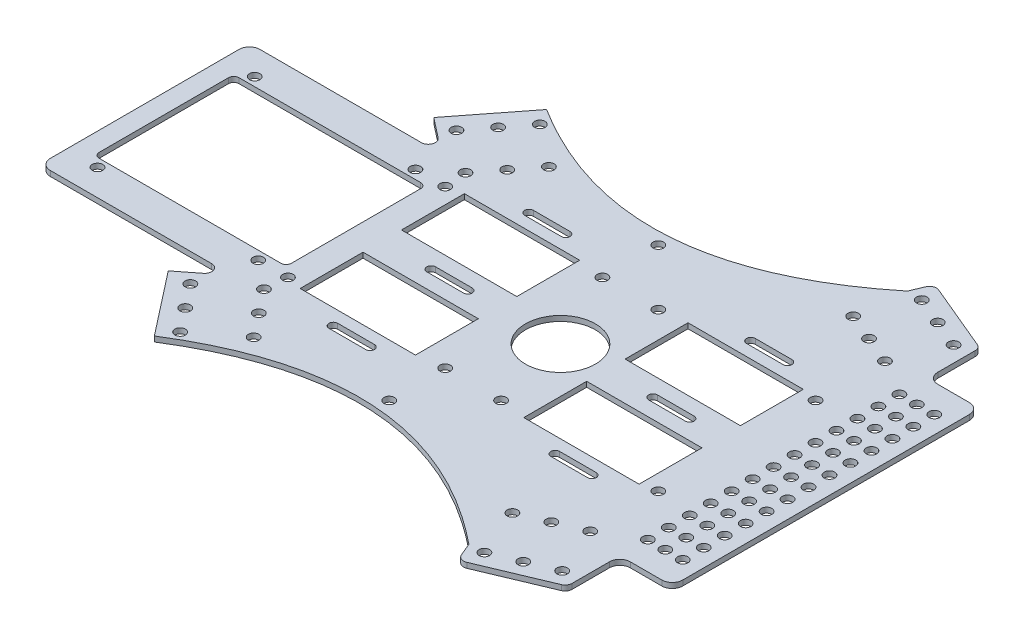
SolidWorks part; units mm, degrees
ref_plane "Спереди" through (0, 0, 0) normal (0, 0, 1) x (1, 0, 0)
ref_plane "Сверху" through (0, 0, 0) normal (0, 1, 0) x (1, 0, 0)
ref_plane "Справа" through (0, 0, 0) normal (1, 0, 0) x (0, 0, -1)
sketch "Эскиз1" plane through (0, 0, 0) normal (0, 1, 0) x (1, 0, 0)
  line L0 (-19.0468, 0) -> (190.9532, 0) construction
  line L1 (0, -27) -> (0, 27)
  line L2 (3, 30) -> (49.1883, 30)
  line L3 (50.419, 33.5765) -> (44.753, 38)
  line L4 (44.753, 38) -> (58.9069, 56.1292)
  line L5 (195, -41) -> (195, 41)
  line L6 (192, 44) -> (183, 44)
  line L7 (180, 47) -> (180, 57.6706)
  line L8 (178.7742, 59.5146) -> (159.7152, 67.5162)
  line L9 (157.0969, 66.4463) -> (155.5485, 62.7581)
  line L10 (157.0969, -66.4463) -> (155.5485, -62.7581)
  line L11 (178.7742, -59.5146) -> (159.7152, -67.5162)
  line L12 (180, -47) -> (180, -57.6706)
  line L13 (192, -44) -> (183, -44)
  line L14 (44.753, -38) -> (58.9069, -56.1292)
  line L15 (50.419, -33.5765) -> (44.753, -38)
  line L16 (3, -30) -> (49.1883, -30)
  arc A0 (0, 27) -> (3, 30) centre (3, 27) cw
  arc A1 (49.1883, 30) -> (50.419, 33.5765) centre (49.1883, 32) ccw
  arc A2 (180, 57.6706) -> (178.7742, 59.5146) centre (178, 57.6706) ccw
  arc A3 (159.7152, 67.5162) -> (157.0969, 66.4463) centre (158.941, 65.6721) ccw
  arc A4 (195, 41) -> (192, 44) centre (192, 41) ccw
  arc A5 (183, 44) -> (180, 47) centre (183, 47) cw
  arc A6 (183, -44) -> (180, -47) centre (183, -47) ccw
  arc A7 (195, -41) -> (192, -44) centre (192, -41) cw
  arc A8 (159.7152, -67.5162) -> (157.0969, -66.4463) centre (158.941, -65.6721) cw
  arc A9 (180, -57.6706) -> (178.7742, -59.5146) centre (178, -57.6706) cw
  arc A10 (49.1883, -30) -> (50.419, -33.5765) centre (49.1883, -32) cw
  arc A11 (0, -27) -> (3, -30) centre (3, -27) ccw
  spline S0 degree 2 poles (58.9069, 56.1292) (108.8246, 24.8356) (155.5485, 62.7581) knots 0 0 0 1 1 1
  spline S1 degree 2 poles (58.9069, -56.1292) (108.8246, -24.8356) (155.5485, -62.7581) knots 0 0 0 1 1 1
  point P17 (0, 30)
  point P20 (55, 30)
  point P23 (180, 59)
  point P26 (157.8711, 68.2904)
  point P29 (195, 44)
  point P32 (180, 44)
  point P34 (195, 0)
  point P35 (0, 0)
  point P55 (180, -44)
  point P56 (195, -44)
  point P57 (157.8711, -68.2904)
  point P58 (180, -59)
  point P59 (55, -30)
  point P60 (0, -30)
  dimension "D12" = 3
  dimension "D13" = 2
  dimension "D14" = 2
  dimension "D15" = 3
  dimension "D1" = 55
  dimension "D2" = 13
  dimension "D3" = 8
  dimension "D4" = 23
  dimension "D5" = 44
  dimension "D6" = 195
  dimension "D7" = 15
  dimension "D8" = 15
  dimension "D9" = 24
  dimension "D10" = 90
  dimension "D11" = 42
extrude "Бобышка-Вытянуть2" add sketch "Эскиз1" along normal blind 1.5
sketch "Эскиз5" plane through (0, 1.5, 0) normal (0, 1, 0) x (1, 0, 0)
  line L0 (-5.1377, 0) -> (72.518, 0) construction
  line L1 (0, 27) -> (0, -27) construction
  line L2 (7, 20) -> (59, 20)
  line L3 (5.5, 18.5) -> (5.5, -18.5)
  line L4 (7, -20) -> (59, -20)
  line L5 (60.5, 18.5) -> (60.5, -18.5)
  line L6 (5.5, 20) -> (60.5, -20) construction
  line L7 (5.5, -20) -> (60.5, 20) construction
  arc A0 (5.5, -18.5) -> (7, -20) centre (7, -18.5) ccw
  arc A1 (59, -20) -> (60.5, -18.5) centre (59, -18.5) ccw
  arc A2 (59, 20) -> (60.5, 18.5) centre (59, 18.5) cw
  arc A3 (7, 20) -> (5.5, 18.5) centre (7, 18.5) ccw
  point P3 (33, 0)
  dimension "D1" = 40
  dimension "D4" = 1.5
  dimension "D2" = 55
  dimension "D3" = 5.5
extrude "дыры под мозгом" cut sketch "Эскиз5" against normal through all
sketch "Эскиз6" plane through (0, 1.5, 0) normal (0, 1, 0) x (1, 0, 0)
  line L0 (-28.3535, 0) -> (207.1956, 0) construction
  line L1 (0, 27) -> (0, -27) construction
  line L2 (68, 5.5) -> (101, 5.5)
  line L3 (68, 5.5) -> (68, 23.5)
  line L4 (68, 23.5) -> (101, 23.5)
  line L5 (101, 5.5) -> (101, 23.5)
  line L6 (132, 23.5) -> (165, 23.5)
  line L7 (132, 23.5) -> (132, 5.5)
  line L8 (132, 5.5) -> (165, 5.5)
  line L9 (165, 23.5) -> (165, 5.5)
  line L10 (195, -41) -> (195, 41) construction
  line L11 (145.5, 0) -> (156, 0) construction
  line L12 (145.5, 1.25) -> (156, 1.25)
  line L13 (145.5, -1.25) -> (156, -1.25)
  line L14 (82, 0) -> (92.5, 0) construction
  line L15 (82, 1.25) -> (92.5, 1.25)
  line L16 (82, -1.25) -> (92.5, -1.25)
  line L17 (145.5, 28) -> (156, 28) construction
  line L18 (145.5, 29.25) -> (156, 29.25)
  line L19 (145.5, 26.75) -> (156, 26.75)
  line L20 (82, 28) -> (92.5, 28) construction
  line L21 (82, 29.25) -> (92.5, 29.25)
  line L22 (82, 26.75) -> (92.5, 26.75)
  line L23 (145.5, -28) -> (156, -28) construction
  line L24 (145.5, -29.25) -> (156, -29.25)
  line L25 (145.5, -26.75) -> (156, -26.75)
  line L26 (82, -28) -> (92.5, -28) construction
  line L27 (82, -29.25) -> (92.5, -29.25)
  line L28 (82, -26.75) -> (92.5, -26.75)
  line L29 (165, -23.5) -> (165, -5.5)
  line L30 (132, -5.5) -> (165, -5.5)
  line L31 (132, -23.5) -> (132, -5.5)
  line L32 (132, -23.5) -> (165, -23.5)
  line L33 (101, -5.5) -> (101, -23.5)
  line L34 (68, -23.5) -> (101, -23.5)
  line L35 (68, -5.5) -> (68, -23.5)
  line L36 (68, -5.5) -> (101, -5.5)
  circle A0 centre (119, 0) radius 10
  arc A1 (145.5, 1.25) -> (145.5, -1.25) centre (145.5, 0) ccw
  arc A2 (156, -1.25) -> (156, 1.25) centre (156, 0) ccw
  arc A3 (82, 1.25) -> (82, -1.25) centre (82, 0) ccw
  arc A4 (92.5, -1.25) -> (92.5, 1.25) centre (92.5, 0) ccw
  arc A5 (145.5, 29.25) -> (145.5, 26.75) centre (145.5, 28) ccw
  arc A6 (156, 26.75) -> (156, 29.25) centre (156, 28) ccw
  arc A7 (82, 29.25) -> (82, 26.75) centre (82, 28) ccw
  arc A8 (92.5, 26.75) -> (92.5, 29.25) centre (92.5, 28) ccw
  arc A9 (145.5, -29.25) -> (145.5, -26.75) centre (145.5, -28) cw
  arc A10 (156, -26.75) -> (156, -29.25) centre (156, -28) cw
  arc A11 (82, -29.25) -> (82, -26.75) centre (82, -28) cw
  arc A12 (92.5, -26.75) -> (92.5, -29.25) centre (92.5, -28) cw
  point P19 (150.75, 0)
  point P26 (87.25, 0)
  point P33 (150.75, 28)
  point P40 (87.25, 28)
  point P47 (150.75, -28)
  point P54 (87.25, -28)
  dimension "D9" = 76
  dimension "D1" = 18
  dimension "D2" = 33
  dimension "D3" = 18
  dimension "D4" = 33
  dimension "D5" = 5.5
  dimension "D6" = 5.5
  dimension "D7" = 68
  dimension "D8" = 30
  dimension "D10" = 2.5
  dimension "D11" = 10.5
  dimension "D12" = 39
  dimension "D13" = 82
extrude "дыры центр" cut sketch "Эскиз6" against normal through all
sketch "Эскиз7" plane through (0, 1.5, 0) normal (0, 1, 0) x (1, 0, 0)
  line L0 (195, -41) -> (195, 41) construction
  line L1 (192, 44) -> (183, 44) construction
  circle A0 centre (190, 36) radius 1.5
  circle A1 centre (185, 36) radius 1.5
  circle A2 centre (180, 36) radius 1.5
  circle A3 centre (190, 30) radius 1.5
  circle A4 centre (185, 30) radius 1.5
  circle A5 centre (180, 30) radius 1.5
  circle A6 centre (190, 24) radius 1.5
  circle A7 centre (185, 24) radius 1.5
  circle A8 centre (180, 24) radius 1.5
  circle A9 centre (190, 18) radius 1.5
  circle A10 centre (185, 18) radius 1.5
  circle A11 centre (180, 18) radius 1.5
  circle A12 centre (190, 12) radius 1.5
  circle A13 centre (185, 12) radius 1.5
  circle A14 centre (180, 12) radius 1.5
  circle A15 centre (190, 6) radius 1.5
  circle A16 centre (185, 6) radius 1.5
  circle A17 centre (180, 6) radius 1.5
  circle A18 centre (190, 0) radius 1.5
  circle A19 centre (185, 0) radius 1.5
  circle A20 centre (180, 0) radius 1.5
  circle A21 centre (190, -6) radius 1.5
  circle A22 centre (185, -6) radius 1.5
  circle A23 centre (180, -6) radius 1.5
  circle A24 centre (190, -12) radius 1.5
  circle A25 centre (185, -12) radius 1.5
  circle A26 centre (180, -12) radius 1.5
  circle A27 centre (190, -18) radius 1.5
  circle A28 centre (185, -18) radius 1.5
  circle A29 centre (180, -18) radius 1.5
  circle A30 centre (190, -24) radius 1.5
  circle A31 centre (185, -24) radius 1.5
  circle A32 centre (180, -24) radius 1.5
  circle A33 centre (190, -30) radius 1.5
  circle A34 centre (185, -30) radius 1.5
  circle A35 centre (180, -30) radius 1.5
  circle A36 centre (190, -36) radius 1.5
  circle A37 centre (185, -36) radius 1.5
  circle A38 centre (180, -36) radius 1.5
  dimension "D1" = 3
  dimension "D2" = 3
  dimension "D3" = 3
  dimension "D4" = 5
  dimension "D5" = 5
  dimension "D6" = 5
  dimension "D7" = 8
  dimension "D8" = 13
extrude "масив отв перед" cut sketch "Эскиз7" against normal through all
sketch "Эскиз8" plane through (0, 1.5, 0) normal (0, 1, 0) x (1, 0, 0)
  line L0 (44.753, 38) -> (50.419, 33.5765) construction
  line L1 (58.9069, 56.1292) -> (44.753, 38) construction
  line L2 (157.0969, 66.4463) -> (155.5485, 62.7581) construction
  line L3 (178.7742, 59.5146) -> (159.7152, 67.5162) construction
  line L4 (-22.3731, 0) -> (210.2854, 0) construction
  circle A0 centre (51.1557, 38.076) radius 1.5
  circle A1 centre (56.3865, 44.7759) radius 1.5
  circle A2 centre (61.6173, 51.4758) radius 1.5
  circle A3 centre (62.9791, 28.8452) radius 1.5
  circle A4 centre (68.2099, 35.5451) radius 1.5
  circle A5 centre (73.4407, 42.2451) radius 1.5
  circle A6 centre (159.8173, 62.5928) radius 1.5
  circle A7 centre (167.6546, 59.3025) radius 1.5
  circle A8 centre (175.4919, 56.0121) radius 1.5
  circle A9 centre (154.0108, 48.7622) radius 1.5
  circle A10 centre (161.8481, 45.4719) radius 1.5
  circle A11 centre (169.6855, 42.1815) radius 1.5
  circle A12 centre (159.8173, -62.5928) radius 1.5
  circle A13 centre (167.6546, -59.3025) radius 1.5
  circle A14 centre (175.4919, -56.0121) radius 1.5
  circle A15 centre (169.6855, -42.1815) radius 1.5
  circle A16 centre (161.8481, -45.4719) radius 1.5
  circle A17 centre (154.0108, -48.7622) radius 1.5
  circle A18 centre (51.1557, -38.076) radius 1.5
  circle A19 centre (62.9791, -28.8452) radius 1.5
  circle A20 centre (68.2099, -35.5451) radius 1.5
  circle A21 centre (56.3865, -44.7759) radius 1.5
  circle A22 centre (61.6173, -51.4758) radius 1.5
  circle A23 centre (73.4407, -42.2451) radius 1.5
  dimension "D1" = 3
  dimension "D2" = 3
  dimension "D3" = 3
  dimension "D8" = 3
  dimension "D9" = 3
  dimension "D10" = 3
  dimension "D4" = 4
  dimension "D5" = 8.5
  dimension "D6" = 8.5
  dimension "D7" = 5
  dimension "D11" = 4
  dimension "D12" = 4.5
  dimension "D13" = 4.5
  dimension "D14" = 4.5
  dimension "D15" = 8.5
  dimension "D16" = 8.5
  dimension "D17" = 2
  dimension "D18" = 2
extrude "отв под лучи" cut sketch "Эскиз8" against normal through all
sketch "Эскиз9" plane through (0, 1.5, 0) normal (0, 1, 0) x (1, 0, 0)
  line L0 (0, 27) -> (0, -27) construction
  line L1 (49.1883, 30) -> (3, 30) construction
  line L3 (-6.9656, 0) -> (200.3409, 0) construction
  circle A0 centre (9, 22.5) radius 1.5
  circle A1 centre (63.5, 22.5) radius 1.5
  circle A2 centre (55, 22.5) radius 1.5
  circle A3 centre (108.5, 22.5) radius 1.5
  circle A4 centre (124.5, 22.5) radius 1.5
  circle A5 centre (169.5, 22.5) radius 1.5
  circle A6 centre (108.5, 38.5) radius 1.5
  circle A7 centre (169.5, -22.5) radius 1.5
  circle A8 centre (124.5, -22.5) radius 1.5
  circle A9 centre (108.5, -38.5) radius 1.5
  circle A10 centre (108.5, -22.5) radius 1.5
  circle A11 centre (63.5, -22.5) radius 1.5
  circle A12 centre (55, -22.5) radius 1.5
  circle A13 centre (9, -22.5) radius 1.5
  dimension "D1" = 9
  dimension "D13" = 16
  dimension "D2" = 7.5
  dimension "D3" = 7.5
  dimension "D4" = 7.5
  dimension "D5" = 7.5
  dimension "D6" = 7.5
  dimension "D7" = 7.5
  dimension "D8" = 46
  dimension "D9" = 8.5
  dimension "D10" = 45
  dimension "D11" = 16
  dimension "D12" = 45
extrude "креп отв" cut sketch "Эскиз9" against normal through all
